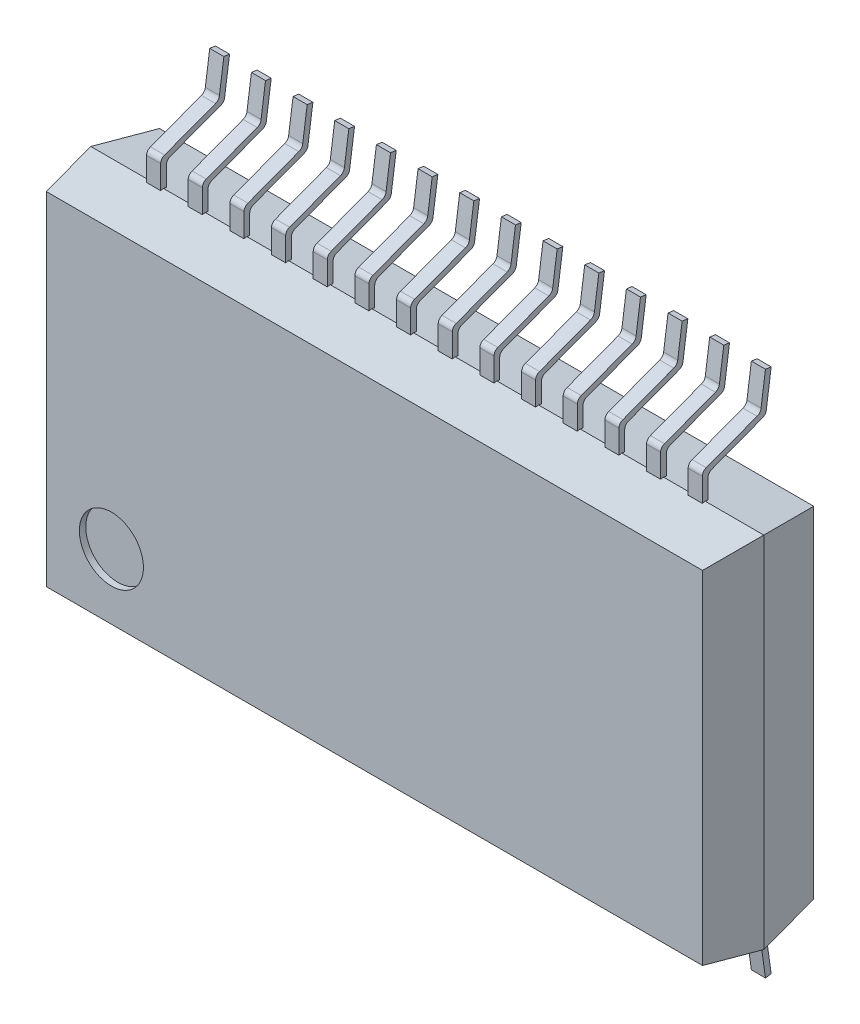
SolidWorks part; units mm, degrees
ref_plane "Plano frontal" through (0, 0, 0) normal (0, 0, 1) x (1, 0, 0)
ref_plane "Plano superior" through (0, 0, 0) normal (0, 1, 0) x (1, 0, 0)
ref_plane "Plano direito" through (0, 0, 0) normal (1, 0, 0) x (0, 0, -1)
sketch "Esboço1" plane through (0, 0, 0) normal (0, 0, 1) x (1, 0, 0)
  line L1 (-0.915, 5.6) -> (9.585, 5.6)
  line L2 (-0.915, 5.6) -> (-0.915, 0)
  line L3 (-0.915, 0) -> (9.585, 0)
  line L4 (9.585, 5.6) -> (9.585, 0)
extrude "Extrusão1" add sketch "Esboço1" along normal blind 0.925 draft 9
sketch "Esboço2" plane through (0, 0, 0) normal (0, 0, 1) x (1, 0, 0)
  line L0 (-0.915, 5.6) -> (9.585, 5.6)
  line L1 (-0.915, 5.6) -> (-0.915, 0)
  line L2 (-0.915, 0) -> (9.585, 0)
  line L3 (9.585, 5.6) -> (9.585, 0)
extrude "Extrusão2" add sketch "Esboço2" against normal blind 0.925 draft 9 separate body
sketch "Esboço3" plane through (0, 0, 0) normal (1, 0, 0) x (0, 0, -1)
  line L2 (1.03, 6.9) -> (0.9409, 6.9125)
  line L4 (-0.045, 5.9583) -> (-0.045, 5.5929)
  line L5 (1.03, 6.9) -> (0.9527, 6.35)
  line L6 (0.0164, 6.0437) -> (0.8104, 6.3425)
  line L7 (0.8719, 6.4214) -> (0.9409, 6.9125)
  line L8 (0.045, 5.896) -> (0.045, 5.5929)
  line L9 (0, 0) -> (0.045, 0.0071)
  line L10 (0.1064, 5.9814) -> (0.8953, 6.2783)
  line L11 (-0.925, 5.4535) -> (0, 5.6) construction
  line L12 (0.925, 5.4535) -> (0, 5.6) construction
  line L13 (-0.045, 5.5929) -> (0, 5.6)
  line L14 (0, 5.6) -> (0.045, 5.5929)
  line L15 (-0.045, 0.0071) -> (0, 0)
  line L16 (0.1064, -0.3814) -> (0.8953, -0.6783)
  line L17 (0.045, -0.296) -> (0.045, 0.0071)
  line L18 (0.8719, -0.8214) -> (0.9409, -1.3125)
  line L19 (0.0164, -0.4437) -> (0.8104, -0.7425)
  line L20 (1.03, -1.3) -> (0.9527, -0.75)
  line L21 (-0.045, -0.3583) -> (-0.045, 0.0071)
  line L22 (1.03, -1.3) -> (0.9409, -1.3125)
  arc A0 (-0.045, 5.9583) -> (0.0164, 6.0437) centre (0.0429, 5.9598) cw
  arc A1 (0.045, 5.896) -> (0.1064, 5.9814) centre (0.1329, 5.8976) cw
  arc A2 (0.8953, 6.2783) -> (0.9527, 6.35) centre (0.8614, 6.3643) ccw
  arc A3 (0.8719, 6.4214) -> (0.8104, 6.3425) centre (0.7796, 6.4299) cw
  arc A4 (0.8719, -0.8214) -> (0.8104, -0.7425) centre (0.7796, -0.8299) ccw
  arc A5 (0.8953, -0.6783) -> (0.9527, -0.75) centre (0.8614, -0.7643) cw
  arc A6 (0.045, -0.296) -> (0.1064, -0.3814) centre (0.1329, -0.2976) ccw
  arc A7 (-0.045, -0.3583) -> (0.0164, -0.4437) centre (0.0429, -0.3598) ccw
extrude "Extrusão3" add sketch "Esboço3" along normal blind 0.22 separate body
pattern_linear "Padrão linear2" count 14 spacing 0.65 along (1, 0, 0)
sketch "Esboço7" plane through (0, 0, 0) normal (0, 0, 1) x (1, 0, 0)
  circle A1 centre (0.2315, 1.1465) radius 0.5
extrude "Corte-extrusão1" cut sketch "Esboço7" along normal blind 0.2 and the other way blind 0.2 from surface at 0.925
sketch "Sketch2" plane through (0, 0, 0.925) normal (0, 0, 1) x (1, 0, 0)
  line L1 (-1.4823, 6.0834) -> (9.8719, 6.0834)
  line L2 (-1.4823, 6.0834) -> (-1.4823, -0.3094)
  line L3 (-1.4823, -0.3094) -> (9.8719, -0.3094)
  line L4 (9.8719, 6.0834) -> (9.8719, -0.3094)
extrude "Cut-Extrude1" cut sketch "Sketch2" against normal blind 0.1
